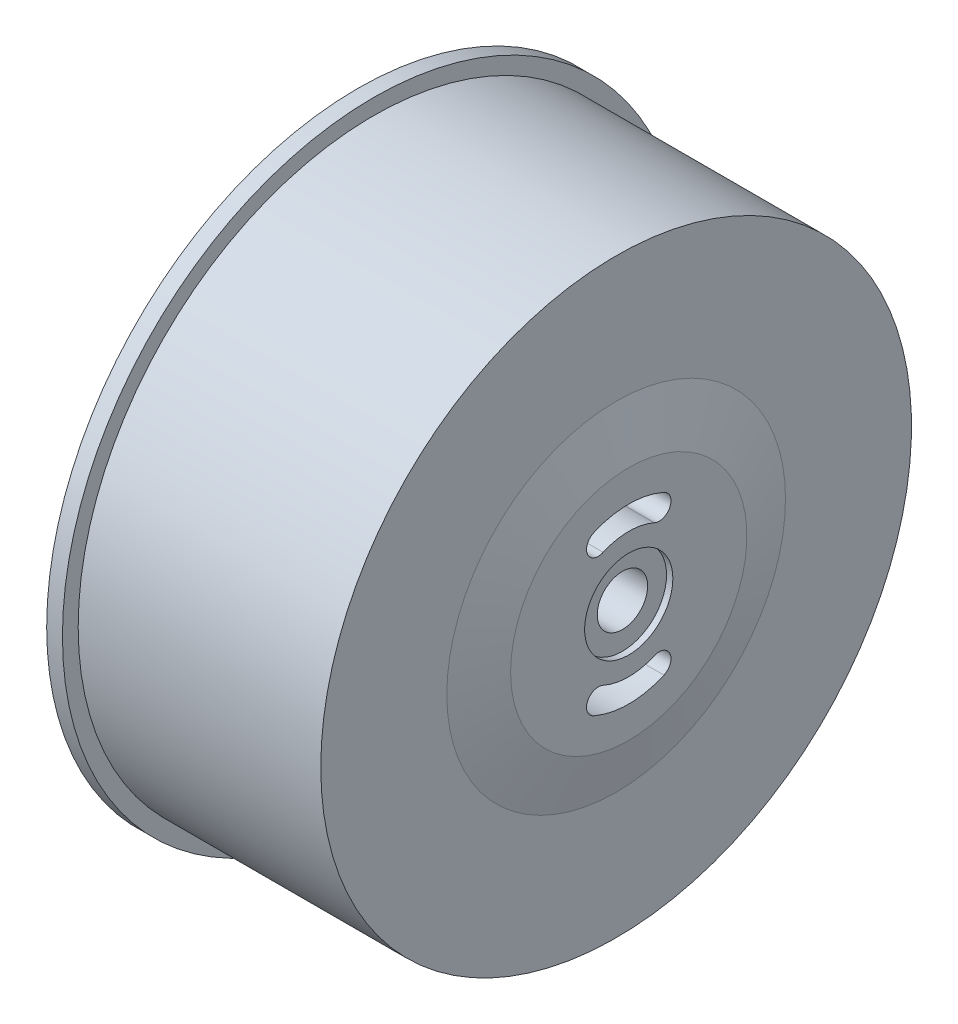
SolidWorks part; units mm, degrees
ref_plane "Plan de face" through (0, 0, 0) normal (0, 0, 1) x (1, 0, 0)
ref_plane "Plan de dessus" through (0, 0, 0) normal (0, 1, 0) x (1, 0, 0)
ref_plane "Plan de droite" through (0, 0, 0) normal (1, 0, 0) x (0, 0, -1)
sketch "Esquisse1" plane through (0, 0, 0) normal (0, 0, 1) x (1, 0, 0)
  line L0 (0, 16.25) -> (0, 19.75)
  line L1 (0, 19.75) -> (1, 19.75)
  line L2 (1, 19.75) -> (1, 18.75)
  line L3 (1, 18.75) -> (16.4, 18.75)
  line L4 (16.4, 18.75) -> (16.4, 10.75)
  line L5 (16.4, 10.75) -> (17.2, 7.5)
  line L6 (17.2, 7.5) -> (17.2, 0)
  line L7 (0, 16.25) -> (14.7, 16.25)
  line L8 (14.7, 16.25) -> (14.7, 0)
  line L9 (14.7, 0) -> (17.2, 0)
  dimension "D1" = 16.25
  dimension "D2" = 1
  dimension "D3" = 19.75
  dimension "D4" = 16.4
  dimension "D5" = 18.75
  dimension "D6" = 7.5
  dimension "D7" = 17.2
  dimension "D8" = 18.75
  dimension "D9" = 10.75
  dimension "D10" = 2.5
revolve "Révolution1" add sketch "Esquisse1" angle 360 about L9
sketch "Esquisse2" plane through (17.2, 0, 0) normal (1, 0, 0) x (0, 0, -1)
  line L0 (0, 0) -> (0, 7.5204) construction
  arc A0 (1.6251, 3.655) -> (-1.6251, 3.655) centre (0, 0) ccw
  arc A1 (2.2345, 5.0256) -> (-2.2345, 5.0256) centre (0, 0) ccw
  arc A2 (1.6251, 3.655) -> (2.2345, 5.0256) centre (1.9298, 4.3403) ccw
  arc A3 (-1.6251, 3.655) -> (-2.2345, 5.0256) centre (-1.9298, 4.3403) cw
  dimension "D1" = 11
  dimension "D2" = 1.5
extrude "Enlèv. mat.-Extru.1" cut sketch "Esquisse2" against normal through all
pattern_circular "Répétition circulaire1" count 2 over 360 about axis through (0, 0, 0) along (1, 0, 0) of "Enlèv. mat.-Extru.1"
sketch "Esquisse3" plane through (14.7, 0, 0) normal (-1, 0, 0) x (0, 0, 1)
  circle A0 centre (0, 0) radius 4
extrude "Extrusion1" add sketch "Esquisse3" along normal blind 3
sketch "Esquisse4" plane through (11.7, 0, 0) normal (-1, 0, 0) x (0, 0, 1)
  circle A0 centre (0, 0) radius 2.5
  dimension "D1" = 5
extrude "Extrusion2" add sketch "Esquisse4" along normal blind 0.8
sketch "Esquisse5" plane through (10.9, 0, 0) normal (-1, 0, 0) x (0, 0, 1)
  circle A0 centre (0, 0) radius 1.6
  dimension "D1" = 3.2
extrude "Enlèv. mat.-Extru.2" cut sketch "Esquisse5" against normal through all
sketch "Esquisse6" plane through (17.2, 0, 0) normal (1, 0, 0) x (0, 0, -1)
  circle A0 centre (0, 0) radius 2.8
  dimension "D1" = 5.6
extrude "Enlèv. mat.-Extru.3" cut sketch "Esquisse6" against normal blind 0.4
